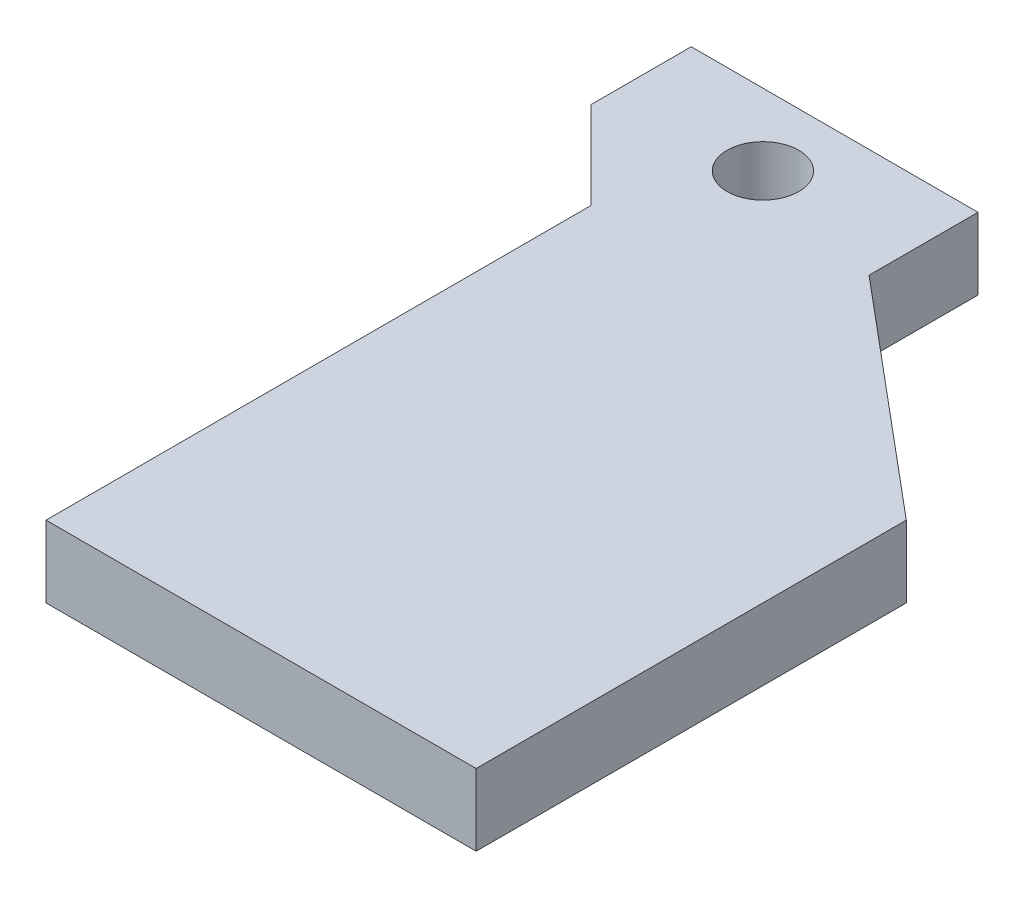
SolidWorks part; units mm, degrees
ref_plane "Front" through (0, 0, 0) normal (0, 0, 1) x (1, 0, 0)
ref_plane "Top" through (0, 0, 0) normal (0, 1, 0) x (1, 0, 0)
ref_plane "Right" through (0, 0, 0) normal (1, 0, 0) x (0, 0, -1)
sketch "Sketch1" plane through (0, 0, 0) normal (0, 1, 0) x (1, 0, 0)
  line L0 (-5.3552, -5.8785) -> (24.6448, -5.8785)
  line L1 (24.6448, -5.8785) -> (24.6448, 24.1215)
  line L2 (-5.3552, -5.8785) -> (-5.3552, 32.1215)
  line L3 (24.6448, 24.1215) -> (8.5526, 37.6137)
  line L4 (8.5526, 37.6137) -> (8.5526, 45.2137)
  line L5 (8.5526, 45.2137) -> (-11.4474, 45.2137)
  line L6 (-11.4474, 45.2137) -> (-11.4474, 38.2137)
  line L7 (-11.4474, 38.2137) -> (-5.3552, 32.1215)
  dimension "D1" = 38
  dimension "D2" = 30
  dimension "D3" = 30
  dimension "D4" = 21
  dimension "D5" = 7.6
  dimension "D6" = 20
  dimension "D7" = 7
  dimension "D8" = 225
extrude "Extrude1" add sketch "Sketch1" along normal blind 5
sketch "Sketch2" plane through (0, 5, 0) normal (0, 1, 0) x (-1, 0, 0)
  line L0 (11.4474, -45.2137) -> (11.4474, -38.2137) construction
  line L1 (-8.5526, -45.2137) -> (11.4474, -45.2137) construction
  circle A0 centre (1.4474, -40.2137) radius 2.5
  dimension "D1" = 10
  dimension "D2" = 5
  dimension "D3" = 5
extrude "Cut-Extrude1" cut sketch "Sketch2" against normal through all
